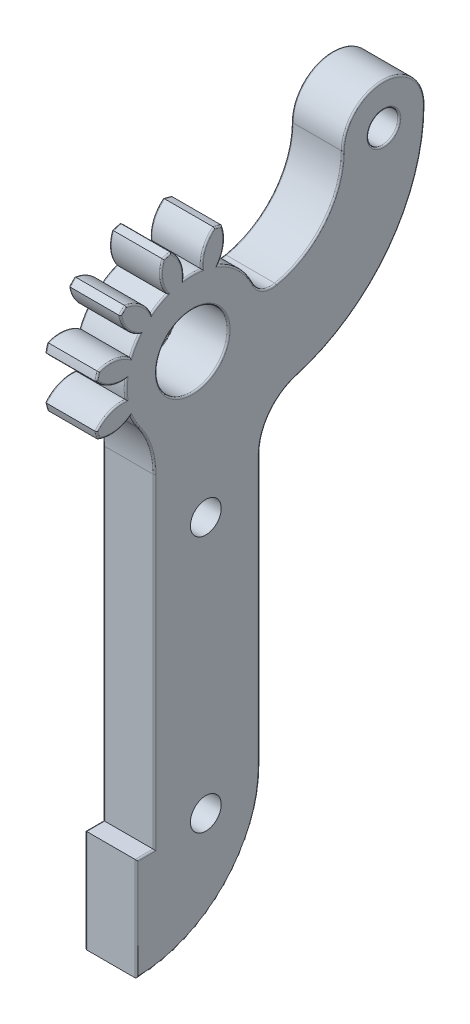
SolidWorks part; units mm, degrees
ref_plane "Front Plane" through (0, 0, 0) normal (0, 0, 1) x (1, 0, 0)
ref_plane "Top Plane" through (0, 0, 0) normal (0, 1, 0) x (1, 0, 0)
ref_plane "Right Plane" through (0, 0, 0) normal (1, 0, 0) x (0, 0, -1)
imported_body "spur gear_iso-3-solid1"
sketch "Sketch2" plane through (2.1035, 0, 0) normal (1, 0, 0) x (0, 0, -1)
  line L0 (-0.0496, 6.7652) -> (0, 0) construction
  line L1 (3.2155, 5.8904) -> (-5.705, -3.0301) construction
  arc A0 (0.8392, 6.7045) -> (-0.9384, 6.7045) centre (-0.0496, 0.235) ccw construction
  arc A1 (3.9548, 5.3934) -> (2.4155, 6.2821) centre (-0.0496, 0.235) ccw construction
  arc A2 (-6.0967, -2.23) -> (-5.2079, -3.7694) centre (-0.0496, 0.235) ccw construction
  arc A3 (-5.705, -3.0301) -> (3.2155, 5.8904) centre (-0.0496, 0.235) ccw
  arc A4 (2.4155, -5.8121) -> (3.9548, -4.9234) centre (-0.0496, 0.235) ccw construction
extrude "Cut-Extrude-Thin1" cut sketch "Sketch2" against normal through all both and the other way through all thin
sketch "Sketch3" plane through (2.1035, 0, 0) normal (1, 0, 0) x (0, 0, -1)
  line L0 (-3.7693, -8.3543) -> (-3.7693, -40)
  line L1 (-3.7693, -40) -> (-5.5193, -40)
  line L2 (-5.5193, -40) -> (-5.5193, -50)
  line L3 (6.4807, -38) -> (6.4807, 0.235)
  line L4 (-5.5193, -50) -> (24.4807, -50) construction
  arc A0 (-5.3167, -3.6252) -> (-3.7693, -8.3543) centre (-11.7693, -8.3543) cw
  arc A1 (-5.705, -3.0301) -> (3.2155, 5.8904) centre (-0.0496, 0.235) ccw construction
  arc A2 (-5.5193, -50) -> (6.4807, -38) centre (-5.5193, -38) ccw
  arc A3 (-5.3167, -3.6252) -> (6.4807, 0.235) centre (-0.0496, 0.235) ccw
  dimension "D3" = 10
  dimension "D5" = 30
  dimension "D1" = 12
  dimension "D6" = 8
  dimension "D2" = 50
  dimension "D4" = 10.25
extrude "Boss-Extrude1" add sketch "Sketch3" against normal up to surface (5 mm away)
sketch "Sketch4" plane through (2.1035, 0, 0) normal (1, 0, 0) x (0, 0, -1)
  line L0 (0, 0) -> (18.5847, 9.7779) construction
  line L1 (-0.0496, 6.7652) -> (0, 0) construction
  circle A0 centre (18.5847, 9.7779) radius 1.5
  circle A1 centre (18.5847, 9.7779) radius 4 construction
  arc A2 (-3.1856, -5.493) -> (22.5847, 9.7779) centre (5.175, 9.7779) ccw
  arc A3 (-5.705, -3.0301) -> (3.2155, 5.8904) centre (-0.0496, 0.235) ccw construction
  arc A4 (14.5847, 9.7779) -> (1.9323, 3.1198) centre (6.5067, 9.7779) cw
  circle A5 centre (-0.0496, 0.235) radius 3.5 construction
  arc A6 (14.5847, 9.7779) -> (22.5847, 9.7779) centre (18.5847, 9.7779) cw
  dimension "D1" = 3
  dimension "D4" = 8
  dimension "D2" = 62.67
  dimension "D3" = 21
extrude "Boss-Extrude2" add sketch "Sketch4" against normal up to surface (5 mm away) contours A6 A4 A2 A0 M4 M30
fillet "Fillet1" radius 2 1 edges at (-0.3965, 1.7021, -6.3137)
fillet "Fillet2" radius 5 1 edges at (-0.3965, -7.5828, -6.4807)
fillet "Fillet3" radius 0.15 68 edges at (2.1035, 1.3621, 8.1359) (2.1035, -0.8921, 8.1359) (2.1035, 0.235, 6.5798) (-2.8965, 1.3621, 8.1359) (-2.8965, 0.235, 6.5798) (2.1035, 9.532, -2.4415) (2.1035, 4.9581, -4.46) (-2.8965, 4.9581, -4.46) (2.1035, -2.8321, 7.616) (2.1035, 8.3213, -1.0775) (-2.8965, -2.8321, 7.616) (2.1035, 8.3213, 1.1767) (2.1035, 6.7652, 0.0496) (-2.8965, 8.3213, -1.0775) (-2.8965, 6.7652, 0.0496) (2.1035, 7.8015, -3.0175) (2.1035, 0.235, 3.5496) (-2.8965, 0.235, -3.4504) (-2.8965, 9.532, 2.5407) (-2.8965, 6.6744, 5.0688) (2.1035, 9.532, 2.5407) (2.1035, 7.8015, 3.1166) (2.1035, 6.6744, 5.0688) (2.1035, 5.8904, 3.3147) (-2.8965, 7.8015, 3.1166) (-2.8965, 5.8904, 3.3147) (-2.8965, -2.9516, 5.7496) (2.1035, -2.9516, 5.7496) (2.1035, -5.8664, 4.166) (2.1035, -24.1771, 3.7693) (2.1035, -40, 4.6443) (2.1035, -45, 5.5193) (2.1035, -46.4853, -2.9659) (2.1035, -24.8632, -6.4807) (-2.8965, -46.4853, -2.9659) (-2.8965, -45, 5.5193) (-2.8965, -40, 4.6443) (-2.8965, -24.1771, 3.7693) (-2.8965, -5.8664, 4.166) (-2.8965, 13.7779, -18.5847) (2.1035, 13.7779, -18.5847) (2.1035, 4.6532, -12.7511) (-2.8965, 9.7779, -20.0847) (2.1035, 9.7779, -20.0847) (-2.8965, -0.6579, -19.1103) (-2.8965, 4.6532, -12.7511) (2.1035, 2.034, -6.7855) (-2.8965, 2.034, -6.7855) (-2.8965, -24.8632, -6.4807) (2.1035, -0.6579, -19.1103) (2.1035, -8.7293, -7.4785) (-2.8965, -8.7293, -7.4785) (-2.8965, -2.2561, 9.3466) (-2.8965, 2.7261, 9.3466) (-2.8965, 7.0409, 6.8555) (-2.8965, 7.8015, -3.0175) (-2.8965, -0.8921, 8.1359) (-2.8965, 3.302, 7.616) (2.1035, -2.2561, 9.3466) (2.1035, 2.7261, 9.3466) (2.1035, 7.0409, 6.8555) (-2.8965, 9.532, -2.4415) (2.1035, 5.2542, 6.489) (2.1035, 3.302, 7.616) (2.1035, 3.5001, 5.705) (-2.8965, 5.2542, 6.489) (-2.8965, 3.5001, 5.705) (-2.8965, 8.3213, 1.1767)
sketch "Sketch5" plane through (-2.8965, 0, 0) normal (-1, 0, 0) x (0, 0, 1)
  circle A0 centre (-1.2307, -14.4108) radius 1.5
  circle A1 centre (-1.2307, -39.4108) radius 1.5
  dimension "D1" = 3
extrude "Cut-Extrude1" cut sketch "Sketch5" against normal up to next
